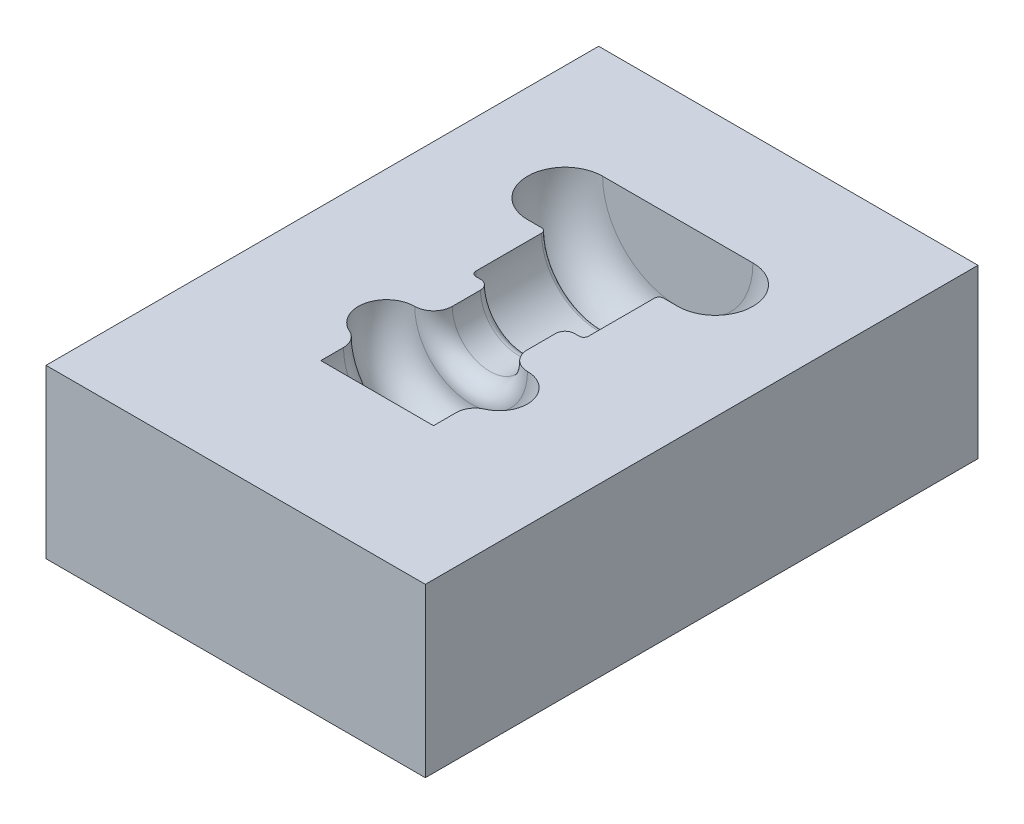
SolidWorks part; units mm, degrees
ref_plane "Front Plane" through (0, 0, 0) normal (0, 0, 1) x (1, 0, 0)
ref_plane "Top Plane" through (0, 0, 0) normal (0, 1, 0) x (1, 0, 0)
ref_plane "Right Plane" through (0, 0, 0) normal (1, 0, 0) x (0, 0, -1)
inserted part "Part4^moldassembly figure 17-12<1>@moldassembly figure 17-12"
sketch "Sketch1" plane through (0, 0, 300) normal (0, 0, 1) x (1, 0, 0)
  line L0 (-127.31, 0) -> (125.8843, 0)
split "Split1" trim tools "Sketch1" bodies to split 101 resulting bodies 104
